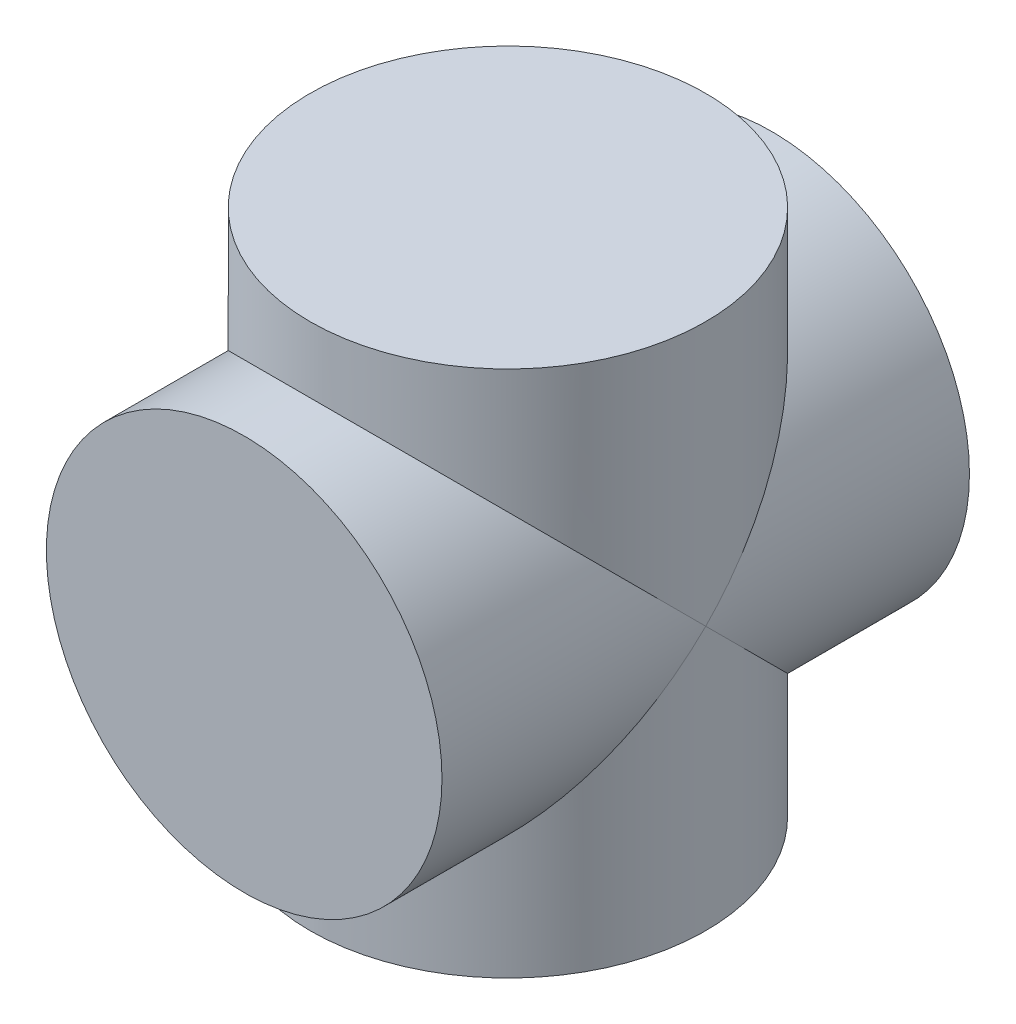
SolidWorks part; units mm, degrees
ref_plane "前视基准面" through (0, 0, 0) normal (0, 0, 1) x (1, 0, 0)
ref_plane "上视基准面" through (0, 0, 0) normal (0, 1, 0) x (1, 0, 0)
ref_plane "右视基准面" through (0, 0, 0) normal (1, 0, 0) x (0, 0, -1)
sketch "草图1" plane through (0, 0, 0) normal (0, 0, 1) x (1, 0, 0)
  circle A0 centre (0, 0) radius 15
  dimension "D1" = 30
extrude "拉伸1" add sketch "草图1" along normal blind 40
ref_plane "基准面1" through (0, 0, 20) normal (0, 0, 1) x (1, 0, 0)
sketch "草图2" plane through (0, 0, 20) normal (0, 0, 1) x (1, 0, 0)
  line L0 (0, 29.3605) -> (0, -30.939) construction
  line L1 (-25.5761, 0) -> (34.2498, 0) construction
  line L2 (-15, 20) -> (-15, 0)
  line L3 (-15, 20) -> (0, 20)
  line L4 (-15, 0) -> (-15, -20)
  line L5 (-15, -20) -> (0, -20)
  line L6 (0, 20) -> (0, -20)
  circle A0 centre (0, 0) radius 15 construction
  dimension "D1" = 20
  dimension "D2" = 20
revolve "旋转1" add sketch "草图2" angle 360 about L0
